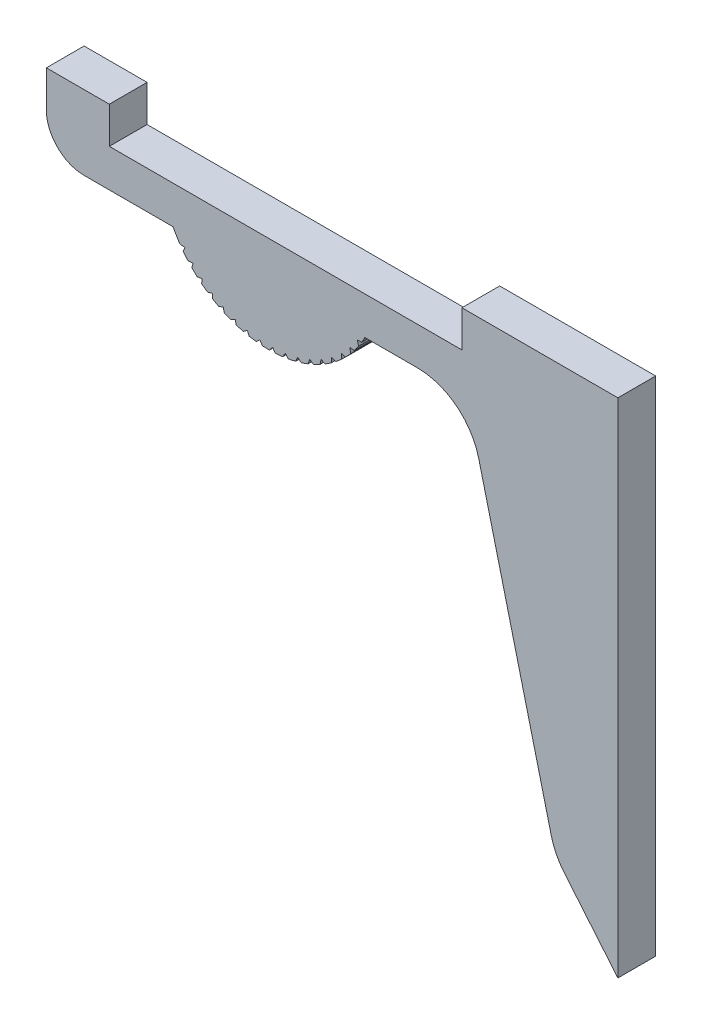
SolidWorks part; units mm, degrees
ref_plane "Plan de face" through (0, 0, 0) normal (0, 0, 1) x (1, 0, 0)
ref_plane "Plan de dessus" through (0, 0, 0) normal (0, 1, 0) x (1, 0, 0)
ref_plane "Plan de droite" through (0, 0, 0) normal (1, 0, 0) x (0, 0, -1)
sketch "Esquisse1" plane through (0, 0, 0) normal (0, 0, 1) x (1, 0, 0)
  line L0 (0, -40) -> (0, 0)
  line L1 (0, 0) -> (-200, 0) construction
  line L2 (0, 0) -> (-45.3847, 0)
  line L3 (-45.3847, 0) -> (-45.3847, -6)
  line L4 (-45.3847, -6) -> (-12, -6)
  line L5 (-12, -6) -> (-5, -34)
  line L6 (-5, -34) -> (0, -40)
  dimension "D1" = 6
  dimension "D2" = 5
  dimension "D3" = 6
  dimension "D4" = 40
  dimension "D5" = 12
extrude "Boss.-Extru.1" add sketch "Esquisse1" against normal blind 3
sketch "Esquisse2" plane through (0, 0, -3) normal (0, 0, -1) x (-1, 0, 0)
  line L1 (12.3847, 0) -> (40.3847, 0)
  line L2 (12.3847, 0) -> (12.3847, -3)
  line L3 (12.3847, -3) -> (40.3847, -3)
  line L4 (40.3847, 0) -> (40.3847, -3)
extrude "Enlèv. mat.-Extru.1" cut sketch "Esquisse2" against normal blind 3
sketch "Esquisse3" plane through (0, 0, 0) normal (0, 0, 1) x (1, 0, 0)
  line L0 (0, -40) -> (0, 0) construction
  line L1 (-45.3847, 0) -> (0, 0)
  line L2 (-45.3847, 0) -> (-45.3847, -0.1)
  line L3 (-45.3847, -0.1) -> (0, -0.1)
  line L4 (0, 0) -> (0, -0.1)
  dimension "D1" = 0.1
extrude "Enlèv. mat.-Extru.2" cut sketch "Esquisse3" against normal blind 10
fillet "Congé1" radius 3 1 edges at (-45.3847, -6, -1.5)
fillet "Congé2" radius 5 2 edges at (-5, -34, -1.5) (-12, -6, -1.5)
sketch "Esquisse4" plane through (0, 0, -3) normal (0, 0, 1) x (1, 0, 0)
  line L0 (-35.322, -6) -> (-20.0903, -6)
  line L45 (-34.7786, -6.9135) -> (-34.3805, -6.9474)
  line L46 (-34.3805, -6.9474) -> (-34.5146, -7.2794)
  line L47 (-34.1379, -7.7394) -> (-33.7386, -7.7245)
  line L48 (-33.7386, -7.7245) -> (-33.8312, -8.0704)
  line L49 (-33.4013, -8.4812) -> (-33.0067, -8.4177)
  line L50 (-33.0067, -8.4177) -> (-33.0566, -8.7723)
  line L51 (-32.5797, -9.1276) -> (-32.1959, -9.0165)
  line L52 (-32.1959, -9.0165) -> (-32.2021, -9.3745)
  line L53 (-31.6856, -9.669) -> (-31.3181, -9.512)
  line L54 (-31.3181, -9.512) -> (-31.2807, -9.8682)
  line L55 (-30.7321, -10.0975) -> (-30.3865, -9.8969)
  line L56 (-30.3865, -9.8969) -> (-30.3059, -10.2458)
  line L57 (-29.7335, -10.4066) -> (-29.4149, -10.1653)
  line L58 (-29.4149, -10.1653) -> (-29.2924, -10.5018)
  line L59 (-28.7046, -10.5916) -> (-28.4179, -10.3134)
  line L60 (-28.4179, -10.3134) -> (-28.2553, -10.6324)
  line L61 (-27.6609, -10.65) -> (-27.4102, -10.3388)
  line L62 (-27.4102, -10.3388) -> (-27.2099, -10.6357)
  line L63 (-26.6179, -10.5806) -> (-26.4069, -10.2412)
  line L64 (-26.4069, -10.2412) -> (-26.172, -10.5115)
  line L65 (-25.5911, -10.3847) -> (-25.423, -10.0221)
  line L66 (-25.423, -10.0221) -> (-25.1569, -10.2618)
  line L67 (-24.5958, -10.0651) -> (-24.4732, -9.6848)
  line L68 (-24.4732, -9.6848) -> (-24.1799, -9.8902)
  line L69 (-23.6469, -9.6266) -> (-23.5715, -9.2341)
  line L70 (-23.5715, -9.2341) -> (-23.2554, -9.4023)
  line L71 (-22.7585, -9.0757) -> (-22.7315, -8.677)
  line L72 (-22.7315, -8.677) -> (-22.3972, -8.8053)
  line L73 (-21.9438, -8.4206) -> (-21.9657, -8.0216)
  line L74 (-21.9657, -8.0216) -> (-21.6182, -8.1083)
  line L75 (-21.2151, -7.6712) -> (-21.2854, -7.2778)
  line L76 (-21.2854, -7.2778) -> (-20.93, -7.3215)
  line L77 (-20.5831, -6.8385) -> (-20.7008, -6.4567)
  line L78 (-20.7008, -6.4567) -> (-20.3427, -6.4567)
  line L79 (-20.0903, -6) -> (-11, -6)
  line L80 (-8, -3) -> (-8, 2)
  line L81 (-8, 2) -> (-10, 4.6088)
  line L82 (-10, 4.6088) -> (-12, 2)
  line L83 (-12, 2) -> (-22.6034, 2)
  line L84 (-22.6034, 2) -> (-22.6034, 13)
  line L85 (-22.6034, 13) -> (-8, 13)
  line L86 (-8, 13) -> (-8, 18)
  line L87 (-11, 21) -> (-42.3847, 21)
  line L88 (-45.3847, 18) -> (-45.3847, -3)
  line L89 (-42.3847, -6) -> (-35.322, -6)
  line L90 (-34.7786, -6.9135) -> (-34.3805, -6.9474)
  line L91 (-34.3805, -6.9474) -> (-34.5146, -7.2794)
  line L92 (-34.1379, -7.7394) -> (-33.7386, -7.7245)
  line L93 (-33.7386, -7.7245) -> (-33.8312, -8.0704)
  line L94 (-33.4013, -8.4812) -> (-33.0067, -8.4177)
  line L95 (-33.0067, -8.4177) -> (-33.0566, -8.7723)
  line L96 (-32.5797, -9.1276) -> (-32.1959, -9.0165)
  line L97 (-32.1959, -9.0165) -> (-32.2021, -9.3745)
  line L98 (-31.6856, -9.669) -> (-31.3181, -9.512)
  line L99 (-31.3181, -9.512) -> (-31.2807, -9.8682)
  line L100 (-30.7321, -10.0975) -> (-30.3865, -9.8969)
  line L101 (-30.3865, -9.8969) -> (-30.3059, -10.2458)
  line L102 (-29.7335, -10.4066) -> (-29.4149, -10.1653)
  line L103 (-29.4149, -10.1653) -> (-29.2924, -10.5018)
  line L104 (-28.7046, -10.5916) -> (-28.4179, -10.3134)
  line L105 (-28.4179, -10.3134) -> (-28.2553, -10.6324)
  line L106 (-27.6609, -10.65) -> (-27.4102, -10.3388)
  line L107 (-27.4102, -10.3388) -> (-27.2099, -10.6357)
  line L108 (-26.6179, -10.5806) -> (-26.4069, -10.2412)
  line L109 (-26.4069, -10.2412) -> (-26.172, -10.5115)
  line L110 (-25.5911, -10.3847) -> (-25.423, -10.0221)
  line L111 (-25.423, -10.0221) -> (-25.1569, -10.2618)
  line L112 (-24.5958, -10.0651) -> (-24.4732, -9.6848)
  line L113 (-24.4732, -9.6848) -> (-24.1799, -9.8902)
  line L114 (-23.6469, -9.6266) -> (-23.5715, -9.2341)
  line L115 (-23.5715, -9.2341) -> (-23.2554, -9.4023)
  line L116 (-22.7585, -9.0757) -> (-22.7315, -8.677)
  line L117 (-22.7315, -8.677) -> (-22.3972, -8.8053)
  line L118 (-21.9438, -8.4206) -> (-21.9657, -8.0216)
  line L119 (-21.9657, -8.0216) -> (-21.6182, -8.1083)
  line L120 (-21.2151, -7.6712) -> (-21.2854, -7.2778)
  line L121 (-21.2854, -7.2778) -> (-20.93, -7.3215)
  line L122 (-20.5831, -6.8385) -> (-20.7008, -6.4567)
  line L123 (-20.7008, -6.4567) -> (-20.3427, -6.4567)
  arc A22 (-34.5146, -7.2794) -> (-34.1379, -7.7394) centre (-27.7061, -2.0885) ccw
  arc A23 (-33.8312, -8.0704) -> (-33.4013, -8.4812) centre (-27.7061, -2.0885) ccw
  arc A24 (-33.0566, -8.7723) -> (-32.5797, -9.1276) centre (-27.7061, -2.0885) ccw
  arc A25 (-32.2021, -9.3745) -> (-31.6856, -9.669) centre (-27.7061, -2.0885) ccw
  arc A26 (-31.2807, -9.8682) -> (-30.7321, -10.0975) centre (-27.7061, -2.0885) ccw
  arc A27 (-30.3059, -10.2458) -> (-29.7335, -10.4066) centre (-27.7061, -2.0885) ccw
  arc A28 (-29.2924, -10.5018) -> (-28.7046, -10.5916) centre (-27.7061, -2.0885) ccw
  arc A29 (-28.2553, -10.6324) -> (-27.6609, -10.65) centre (-27.7061, -2.0885) ccw
  arc A30 (-27.2099, -10.6357) -> (-26.6179, -10.5806) centre (-27.7061, -2.0885) ccw
  arc A31 (-26.172, -10.5115) -> (-25.5911, -10.3847) centre (-27.7061, -2.0885) ccw
  arc A32 (-25.1569, -10.2618) -> (-24.5958, -10.0651) centre (-27.7061, -2.0885) ccw
  arc A33 (-24.1799, -9.8902) -> (-23.6469, -9.6266) centre (-27.7061, -2.0885) ccw
  arc A34 (-23.2554, -9.4023) -> (-22.7585, -9.0757) centre (-27.7061, -2.0885) ccw
  arc A35 (-22.3972, -8.8053) -> (-21.9438, -8.4206) centre (-27.7061, -2.0885) ccw
  arc A36 (-21.6182, -8.1083) -> (-21.2151, -7.6712) centre (-27.7061, -2.0885) ccw
  arc A37 (-20.93, -7.3215) -> (-20.5831, -6.8385) centre (-27.7061, -2.0885) ccw
  arc A38 (-20.3427, -6.4567) -> (-20.0903, -6) centre (-27.7061, -2.0885) ccw
  arc A39 (-11, -6) -> (-8, -3) centre (-11, -3) ccw
  arc A40 (-8, 18) -> (-11, 21) centre (-11, 18) ccw
  arc A41 (-42.3847, 21) -> (-45.3847, 18) centre (-42.3847, 18) ccw
  arc A42 (-45.3847, -3) -> (-42.3847, -6) centre (-42.3847, -3) ccw
  arc A43 (-35.322, -6) -> (-34.7786, -6.9135) centre (-27.7061, -2.0885) ccw
  arc A44 (-34.5146, -7.2794) -> (-34.1379, -7.7394) centre (-27.7061, -2.0885) ccw
  arc A45 (-33.8312, -8.0704) -> (-33.4013, -8.4812) centre (-27.7061, -2.0885) ccw
  arc A46 (-33.0566, -8.7723) -> (-32.5797, -9.1276) centre (-27.7061, -2.0885) ccw
  arc A47 (-32.2021, -9.3745) -> (-31.6856, -9.669) centre (-27.7061, -2.0885) ccw
  arc A48 (-31.2807, -9.8682) -> (-30.7321, -10.0975) centre (-27.7061, -2.0885) ccw
  arc A49 (-30.3059, -10.2458) -> (-29.7335, -10.4066) centre (-27.7061, -2.0885) ccw
  arc A50 (-29.2924, -10.5018) -> (-28.7046, -10.5916) centre (-27.7061, -2.0885) ccw
  arc A51 (-28.2553, -10.6324) -> (-27.6609, -10.65) centre (-27.7061, -2.0885) ccw
  arc A52 (-27.2099, -10.6357) -> (-26.6179, -10.5806) centre (-27.7061, -2.0885) ccw
  arc A53 (-26.172, -10.5115) -> (-25.5911, -10.3847) centre (-27.7061, -2.0885) ccw
  arc A54 (-25.1569, -10.2618) -> (-24.5958, -10.0651) centre (-27.7061, -2.0885) ccw
  arc A55 (-24.1799, -9.8902) -> (-23.6469, -9.6266) centre (-27.7061, -2.0885) ccw
  arc A56 (-23.2554, -9.4023) -> (-22.7585, -9.0757) centre (-27.7061, -2.0885) ccw
  arc A57 (-22.3972, -8.8053) -> (-21.9438, -8.4206) centre (-27.7061, -2.0885) ccw
  arc A58 (-21.6182, -8.1083) -> (-21.2151, -7.6712) centre (-27.7061, -2.0885) ccw
  arc A59 (-20.93, -7.3215) -> (-20.5831, -6.8385) centre (-27.7061, -2.0885) ccw
  arc A60 (-20.3427, -6.4567) -> (-20.0903, -6) centre (-27.7061, -2.0885) ccw
  arc A65 (-35.322, -6) -> (-34.7786, -6.9135) centre (-27.7061, -2.0885) ccw
  dimension "D1" = 0
extrude "Boss.-Extru.2" add sketch "Esquisse4" along normal blind 3
